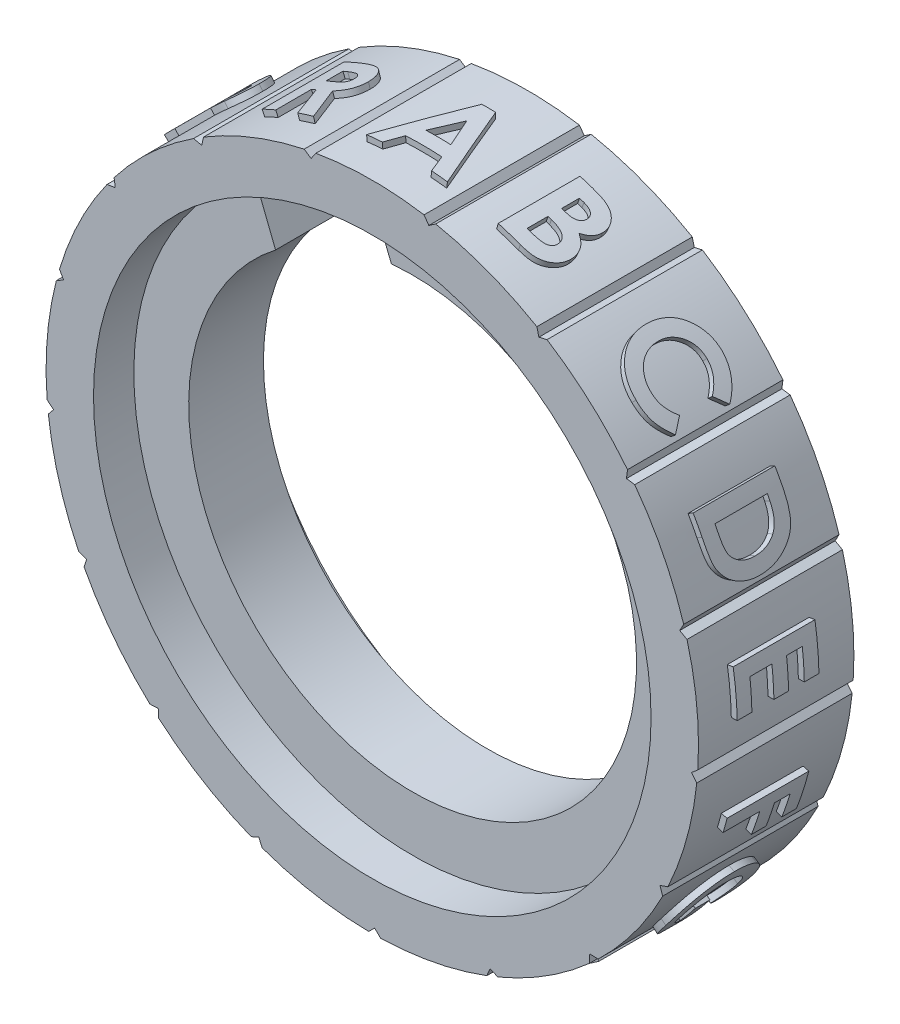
SolidWorks part; units mm, degrees
ref_plane "Front Plane" through (0, 0, 0) normal (0, 0, 1) x (1, 0, 0)
ref_plane "Top Plane" through (0, 0, 0) normal (0, 1, 0) x (1, 0, 0)
ref_plane "Right Plane" through (0, 0, 0) normal (1, 0, 0) x (0, 0, -1)
sketch "Sketch1" plane through (0, 0, 0) normal (0, 0, 1) x (1, 0, 0)
  circle A0 centre (0, 0) radius 13.97
  circle A1 centre (0, 0) radius 11.938
  dimension "D1" = 27.94
  dimension "D2" = 23.876
extrude "Boss-Extrude1" add sketch "Sketch1" along normal mid plane 6.6548
sketch "Sketch2" plane through (0, 0, 0) normal (0, 0, 1) x (1, 0, 0)
  line L0 (0, 0) -> (0, 7.4928) construction
  line L1 (-2.667, 7.4928) -> (2.667, 7.4928)
  line L3 (-2.667, 7.4928) -> (2.667, 7.4928)
  line L4 (-2.667, 7.4928) -> (-2.667, 12.4168)
  line L5 (-2.667, 12.4168) -> (2.667, 12.4168)
  line L6 (2.667, 7.4928) -> (2.667, 12.4168)
  circle A0 centre (0, 0) radius 9.5885
  circle A1 centre (0, 0) radius 12.7
  dimension "D1" = 19.177
  dimension "D4" = 25.4
  dimension "D2" = 5.334
  dimension "D3" = 4.924
extrude "Boss-Extrude2" add sketch "Sketch2" along normal mid plane 3.2004 contours L4 A1 L6 A0 | A0 L6 L5 L4
sketch "Sketch3" plane through (0, 0, 0) normal (0, 1, 0) x (1, 0, 0)
  text T0 "<b>A   B    C   D   E     F   G   H    I     J     K    L   M  N   O   P    R </b>" font "Century Gothic" height 3.5
wrap "Wrap1" sketch "Sketch3" wrap type emboss source sketch "Sketch3" thickness 0.254 parameters "D1"=0.254
sketch "Sketch4" plane through (0, 0, 0) normal (0, 0, 1) x (1, 0, 0)
  line L0 (0, 0) -> (-2.667, 13.7131) construction
  line L1 (-2.667, 13.7131) -> (2.667, 13.7131) construction
  line L2 (2.667, 13.7131) -> (0, 0) construction
  line L3 (-2.6185, 13.4637) -> (-2.9159, 13.6623)
  line L4 (-2.6185, 13.4637) -> (-2.4172, 13.7593)
  circle A0 centre (0, 0) radius 13.97 construction
  circle A1 centre (0, 0) radius 13.97
  dimension "D1" = 0.508
  dimension "D2" = 0.254
extrude "Cut-Extrude1" cut sketch "Sketch4" against normal mid plane 42.2148 contours L4 A1 L3
pattern_circular "CirPattern1" count 17 over 360 about axis through (0, 0, 0) along (0, 0, 1) of "Cut-Extrude1"
sketch "Sketch5" plane through (0, 0, 0) normal (0, 0, 1) x (1, 0, 0)
  line L0 (2.4798, 0.9815) -> (-2.4798, -0.9815)
  line L1 (-2.4798, -0.9815) -> (-6.7623, 9.838)
  line L2 (0, 0) -> (-5.1414, 12.9895) construction
  line L3 (2.4798, 0.9815) -> (-1.8027, 11.8011)
  circle A0 centre (0, 0) radius 11.938
  circle A1 centre (0, 0) radius 11.938 construction
  arc A3 (-2.9159, 13.6623) -> (-7.2244, 11.9569) centre (0, 0) ccw construction
  dimension "D2" = 5.334
  dimension "D1" = 5.334
  dimension "D3" = 11.6363
extrude "Cut-Extrude2" cut sketch "Sketch5" against normal mid plane 17.78 contours L0 L2 A0 L1 | L2 L0 L3 A0
